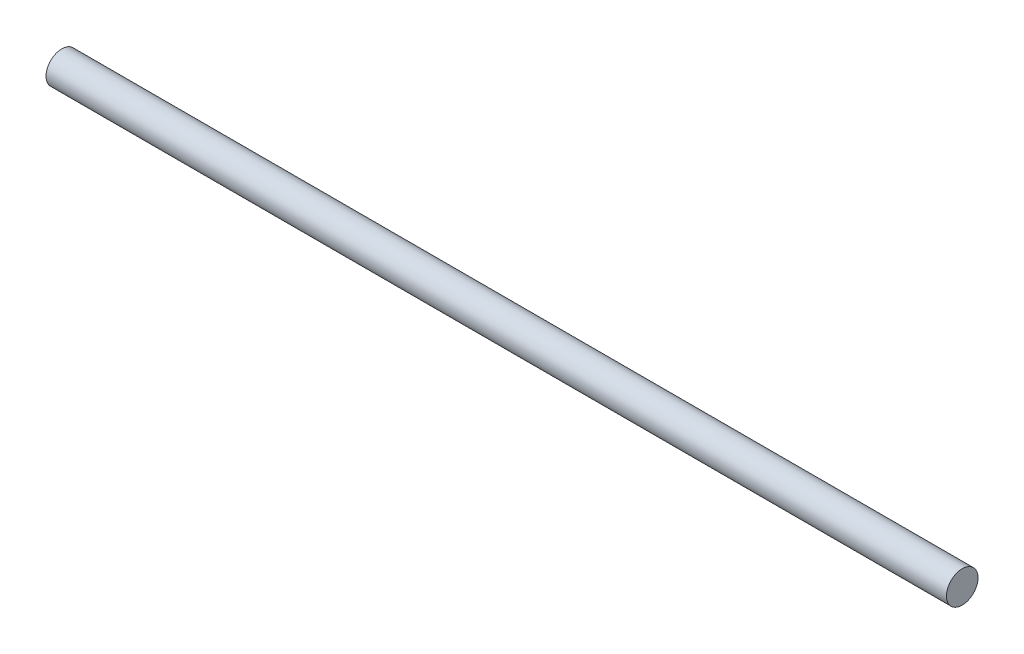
SolidWorks part; units mm, degrees
ref_plane "Front Plane" through (0, 0, 0) normal (0, 0, 1) x (1, 0, 0)
ref_plane "Top Plane" through (0, 0, 0) normal (0, 1, 0) x (1, 0, 0)
ref_plane "Right Plane" through (0, 0, 0) normal (1, 0, 0) x (0, 0, -1)
sketch "Sketch1" plane through (0, 0, 0) normal (0, 0, 1) x (1, 0, 0)
  line L0 (0, 0) -> (0, 6.35)
  line L1 (0, 6.35) -> (361.95, 6.35)
  line L2 (361.95, 6.35) -> (361.95, 0)
  line L3 (361.95, 0) -> (0, 0)
  line L4 (361.95, 0) -> (0, 0) construction
revolve "Revolve1" add sketch "Sketch1" angle 360 about L4
ref_plane "Plane1" through (346.075, 0, 0) normal (1, 0, 0) x (0, 0, -1)
ref_plane "Plane2" through (361.95, 0, 0) normal (1, 0, 0) x (0, 0, -1)
